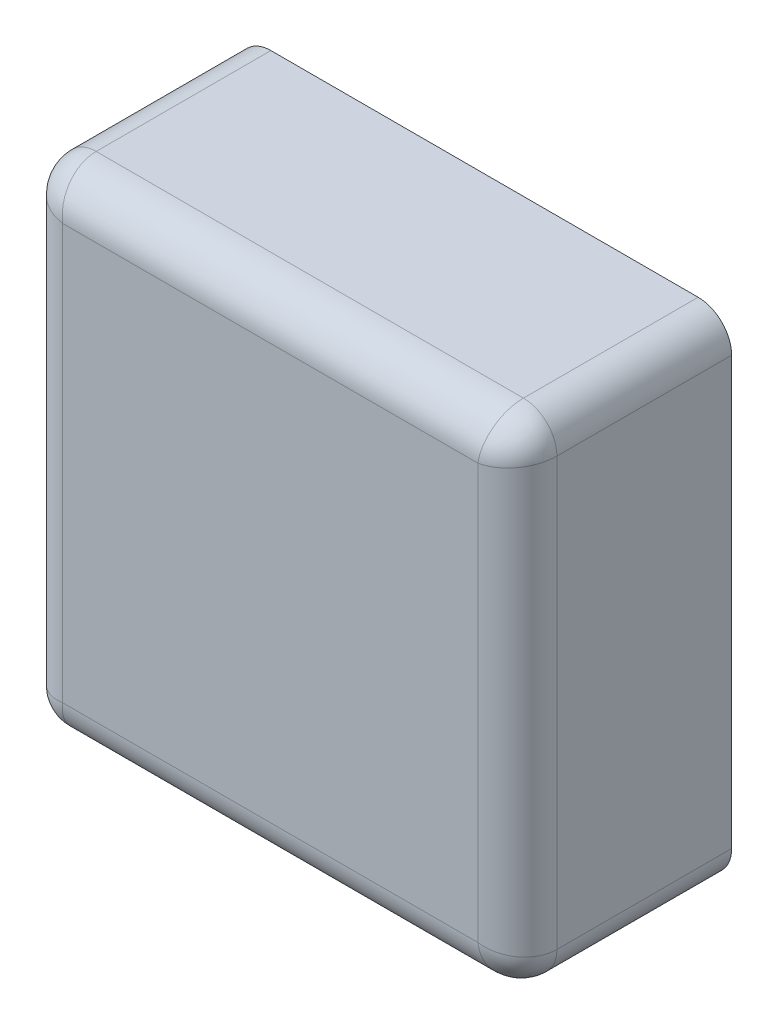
SolidWorks part; units mm, degrees
ref_plane "Front Plane" through (0, 0, 0) normal (1, 0, 0) x (0, 1, 0)
ref_plane "Top Plane" through (0, 0, 0) normal (0, 0, 1) x (0, 1, 0)
ref_plane "Right Plane" through (0, 0, 0) normal (0, 1, 0) x (-1, 0, 0)
sketch "Sketch1" plane through (0, 0, 0) normal (0, 0, 1) x (0, 1, 0)
  line L0 (-9225, -7975.6) -> (-9225, -9225)
  line L1 (-7975.6, 9225) -> (7975.6, 9225)
  line L2 (-9225, 7975.6) -> (-9225, -7975.6)
  line L3 (-7975.6, -9225) -> (7975.6, -9225)
  line L4 (9225, 7975.6) -> (9225, -7975.6)
  line L5 (-9225, 9225) -> (9225, -9225) construction
  line L6 (-9225, -9225) -> (9225, 9225) construction
  line L7 (-7975.6, -9225) -> (-9225, -9225)
  line L8 (7975.6, -9225) -> (9225, -9225)
  line L9 (7975.6, 9225) -> (9225, 9225)
  line L10 (9225, -7975.6) -> (9225, -9225)
  line L11 (9225, 7975.6) -> (9225, 9225)
  line L12 (-7975.6, 9225) -> (-9225, 9225)
  line L13 (-9225, 9225) -> (-9225, 7975.6)
  arc A0 (7975.6, -9225) -> (9225, -7975.6) centre (7975.6, -7975.6) ccw construction
  arc A1 (-9225, -7975.6) -> (-7975.6, -9225) centre (-7975.6, -7975.6) ccw construction
  arc A2 (7975.6, 9225) -> (9225, 7975.6) centre (7975.6, 7975.6) cw construction
  arc A3 (-7975.6, 9225) -> (-9225, 7975.6) centre (-7975.6, 7975.6) ccw construction
  point P0 (0, 0)
  dimension "D3" = 1249.4
  dimension "D1" = 18450
  dimension "D2" = 18450
sketch "Sketch2" plane through (0, 0, 0) normal (0, 0, 1) x (0, 1, 0)
  line L0 (-10000, 0) -> (10000, 0)
  line L1 (-10490.0157, -10490.0157) -> (10490.0157, 10490.0157)
  line L2 (0, 9701.9517) -> (0, -9701.9517)
  line L3 (-10678.2951, 10678.2951) -> (10678.2951, -10678.2951)
  point P2 (0, 0)
  point P5 (0, 0)
  point P8 (0, 0)
  point P12 (0, 0)
  dimension "D1" = 45
  dimension "D2" = 45
sketch "Sketch3" plane through (0, 0, 0) normal (0, 0, 1) x (0, 1, 0)
  line L5 (-8859.0592, -7750.6032) -> (-8859.0592, -8859.0592) construction
  line L6 (-8579.6592, -8030.0032) -> (-8030.0032, -8030.0032) construction
  line L10 (-8579.6592, -8030.0032) -> (-8579.6592, -8579.6592) construction
  line L11 (-8579.6592, -8579.6592) -> (-8030.0032, -8579.6592) construction
  line L12 (-8030.0032, -8030.0032) -> (-8030.0032, -8579.6592) construction
  line L13 (-8859.0592, -8859.0592) -> (-7750.6032, -8859.0592) construction
  line L14 (-7750.6032, -7750.6032) -> (-7750.6032, -8859.0592) construction
  line L15 (-8859.0592, -7750.6032) -> (-7750.6032, -7750.6032) construction
  line L17 (-8350, 8350) -> (8350, 8350)
  line L18 (-8350, 8350) -> (-8350, -8350)
  line L19 (-8350, -8350) -> (8350, -8350)
  line L20 (8350, 8350) -> (8350, -8350)
  line L21 (-8350, 8350) -> (8350, -8350) construction
  line L22 (-8350, -8350) -> (8350, 8350) construction
  point P14 (0, 0)
  dimension "D1" = 549.656
  dimension "D2" = 549.656
  dimension "D4" = 16700
  dimension "D5" = 16700
  dimension "D3" = 279.4
extrude "Boss-Extrude1" add sketch "Sketch1" along normal blind 8000
fillet "Intersection Radius" radius 1249.4 4 edges at (-9225, 9225, 4000) (-9225, -9225, 4000) (9225, 9225, 4000) (9225, -9225, 4000)
fillet "Endcap Radius" radius 1476.8 8 edges at (8859.0592, 8859.0592, 8000) (9225, 0, 8000) (8859.0592, -8859.0592, 8000) (0, -9225, 8000) (-8859.0592, -8859.0592, 8000) (-9225, 0, 8000) (-8859.0592, 8859.0592, 8000) (0, 9225, 8000)
